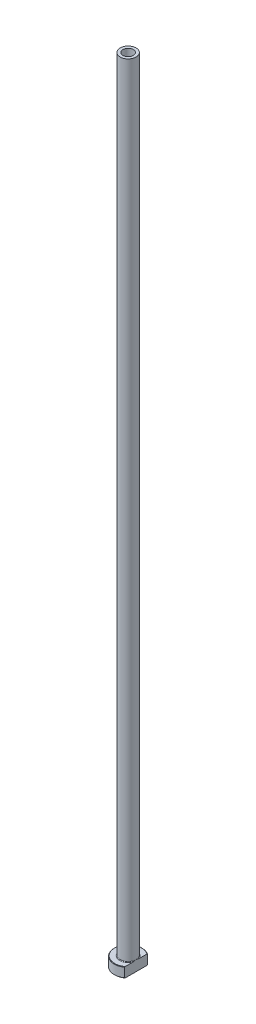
SolidWorks part; units mm, degrees
ref_plane "Front Plane" through (0, 0, 0) normal (0, 0, 1) x (1, 0, 0)
ref_plane "Top Plane" through (0, 0, 0) normal (0, 1, 0) x (1, 0, 0)
ref_plane "Right Plane" through (0, 0, 0) normal (1, 0, 0) x (0, 0, -1)
sketch "Sketch1" plane through (0, 0, 0) normal (0, 0, 1) x (1, 0, 0)
  line L0 (-2.6, 400) -> (-4, 400)
  line L1 (-4, 400) -> (-4, 5)
  line L2 (-4, 5) -> (-7, 5)
  line L3 (-7, 5) -> (-7, 0)
  line L4 (6.05, 0) -> (-6.05, 0) construction
  line L5 (-7, 0) -> (-2.85, 0)
  line L6 (-2.6, 355) -> (-2.6, 400)
  line L7 (0, 92.1877) -> (0, -15.5353) construction
  line L8 (0, -7.7) -> (0, 7.7) construction
  line L9 (-2.6, 355) -> (-2.85, 343)
  line L10 (-2.85, 343) -> (-2.85, 0)
  dimension "D1" = 0.25
  dimension "ID" = 5.2
  dimension "OD" = 8
  dimension "L" = 400
  dimension "H" = 14
  dimension "T" = 5
  dimension "N" = 45
  dimension "D2" = 12
  dimension "L-N" = 355
revolve "Revolve1" add sketch "Sketch1" angle 360 about L7
fillet "Fillet1" radius 0.3 1 edges at (0, 5, 4)
chamfer "Chamfer1" distance 0.2 angle 45 2 edges at (0, 5, 7) (0, 0, 7)
sketch "Sketch2" plane through (0, 0, 0) normal (0, -1, 0) x (1, 0, 0)
  line L0 (4, 5.7446) -> (4, -5.7446)
  circle A0 centre (0, 0) radius 7 construction
  arc A1 (4, 5.7446) -> (4, -5.7446) centre (0, 0) cw
  circle A2 centre (0, 0) radius 4 construction
extrude "Cut-Extrude1" cut sketch "Sketch2" against normal through all
chamfer "Chamfer2" distance 0.5 angle 45 1 edges at (0, 0, 2.85)
